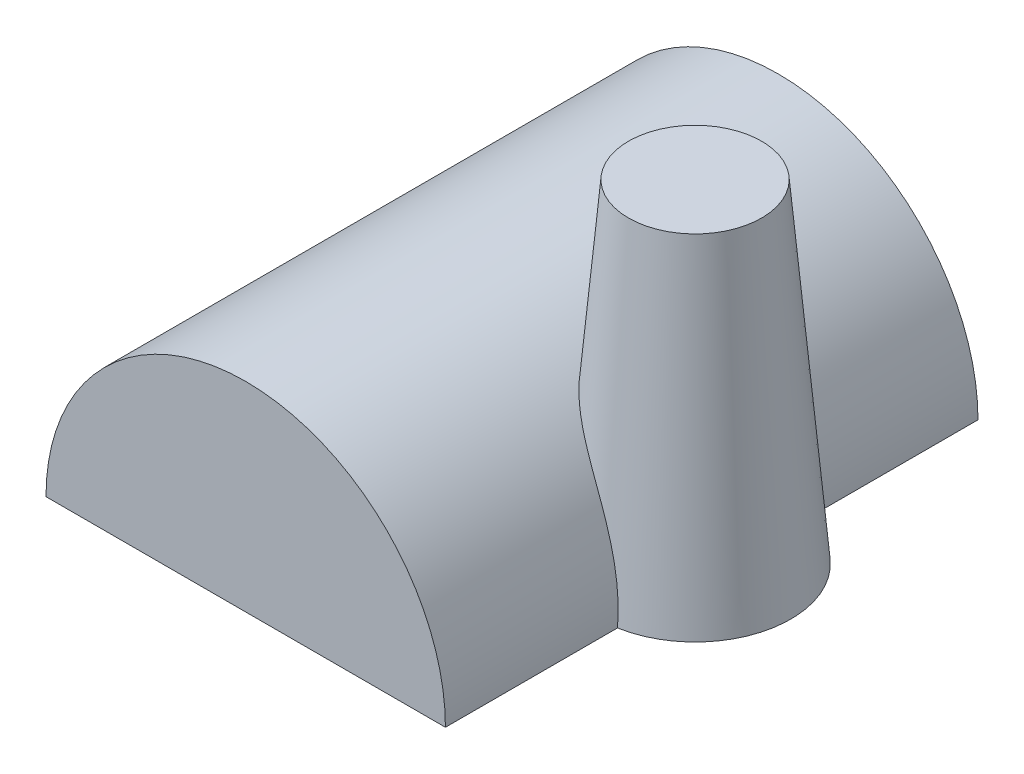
SolidWorks part; units mm, degrees
ref_plane "Front Plane" through (0, 0, 0) normal (0, 0, 1) x (1, 0, 0)
ref_plane "Top Plane" through (0, 0, 0) normal (0, 1, 0) x (1, 0, 0)
ref_plane "Right Plane" through (0, 0, 0) normal (1, 0, 0) x (0, 0, -1)
sketch "Sketch1" plane through (0, 0, 0) normal (0, 0, 1) x (1, 0, 0)
  line L0 (-19.05, 0) -> (19.05, 0)
  arc A0 (19.05, 0) -> (-19.05, 0) centre (0, 0) ccw
  dimension "D1" = 38.1
extrude "Extrude1" add sketch "Sketch1" against normal blind 50.8
ref_plane "Plane1" through (0, 31.75, 0) normal (0, 1, 0) x (-1, 0, 0)
sketch "Sketch2" plane through (0, 31.75, 0) normal (0, 1, 0) x (-1, 0, 0)
  line L0 (19.05, 0) -> (-19.05, 0) construction
  line L1 (-19.05, -50.8) -> (-19.05, 0) construction
  circle A0 centre (-17.4625, -25.4) radius 6.35
  dimension "D3" = 12.7
  dimension "D1" = 25.4
  dimension "D2" = 1.5875
extrude "Extrude2" add sketch "Sketch2" against normal through all draft 5
